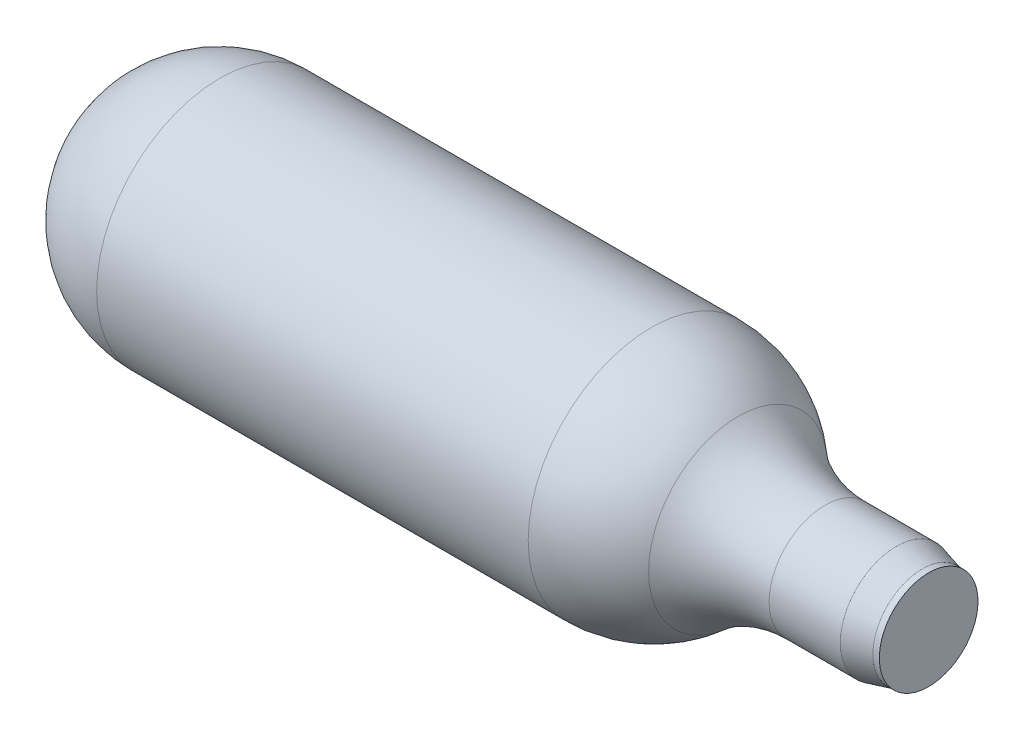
SolidWorks part; units mm, degrees
ref_plane "Front Plane" through (0, 0, 0) normal (0, 0, 1) x (1, 0, 0)
ref_plane "Top Plane" through (0, 0, 0) normal (0, 1, 0) x (1, 0, 0)
ref_plane "Right Plane" through (0, 0, 0) normal (1, 0, 0) x (0, 0, -1)
sketch "Sketch1" plane through (0, 0, 0) normal (0, 0, 1) x (1, 0, 0)
  line L0 (0, 0) -> (64.25, 0)
  line L1 (9.5, 9.5) -> (42.8254, 9.5)
  line L2 (71.9039, 0) -> (83.8195, 0) construction
  line L3 (56.25, 4.325) -> (64.25, 4.325)
  line L4 (64.25, 4.325) -> (64.25, 0)
  arc A0 (0, 0) -> (9.5, 9.5) centre (9.5, 0) cw
  arc A1 (42.8254, 9.5) -> (49.5377, 6.9125) centre (42.8254, -0.5) cw
  arc A2 (49.5377, 6.9125) -> (56.25, 4.325) centre (56.25, 14.325) ccw
  dimension "D4" = 10
  dimension "D1" = 64.25
  dimension "D2" = 19
  dimension "D3" = 8.65
  dimension "D5" = 8
revolve "Revolve1" add sketch "Sketch1" angle 360 about L2
sketch "Sketch2" plane through (64.25, 0, 0) normal (1, 0, 0) x (0, 0, -1)
  circle A0 centre (0, 0) radius 3.81
  dimension "D1" = 7.62
extrude "Cut-Extrude1" cut sketch "Sketch2" against normal blind 0.5 flip side to cut
chamfer "Chamfer1" distance 2 distance2 0.515 1 edges at (63.75, 0, -4.325)
